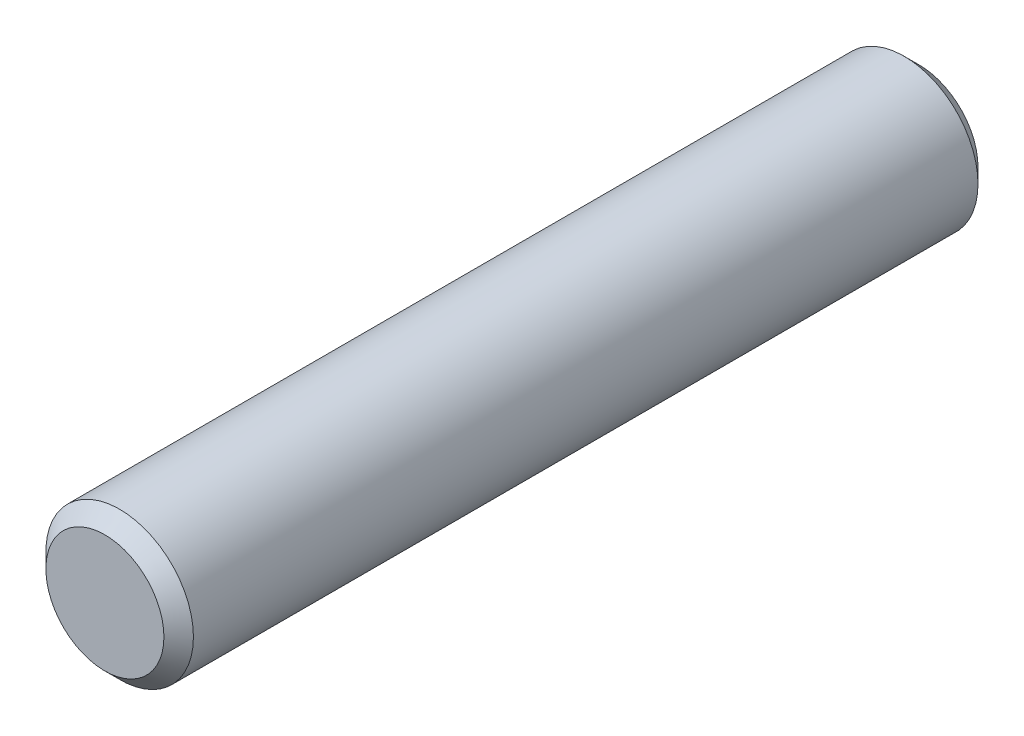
SolidWorks part; units mm, degrees
ref_plane "Front" through (0, 0, 0) normal (0, 0, 1) x (1, 0, 0)
ref_plane "Top" through (0, 0, 0) normal (0, 1, 0) x (1, 0, 0)
ref_plane "Right" through (0, 0, 0) normal (1, 0, 0) x (0, 0, -1)
sketch "Sketch1" plane through (0, 0, 0) normal (1, 0, 0) x (0, 0, -1)
  line L0 (0, 0) -> (65.3053, 0) construction
  line L1 (0, 0) -> (0, 2.541)
  line L2 (0, 2.541) -> (0.6353, 3.1763)
  line L3 (0.6353, 3.1763) -> (35.052, 3.1763)
  line L4 (35.052, 3.1763) -> (35.052, 2.541)
  line L5 (35.052, 2.541) -> (35.6873, 3.1763)
  line L6 (35.6873, 3.1763) -> (330.2, 3.1763)
  line L7 (330.2, 3.1763) -> (330.2, 11.43)
  line L8 (330.2, 11.43) -> (332.74, 12.7)
  line L9 (332.74, 12.7) -> (353.06, 12.7)
  line L10 (353.06, 12.7) -> (355.6, 10.16)
  line L11 (355.6, 10.16) -> (355.6, 0)
  line L12 (0, 0) -> (355.6, 0)
revolve "Revolve1" add sketch "Sketch1" angle 360 about L0
sketch "Sketch2" plane through (0, 0, -330.2) normal (0, 0, 1) x (1, 0, 0)
  circle A0 centre (0, 0) radius 53.975
  dimension "D1" = 107.95
extrude "Type123-N" [suppressed] cut sketch "Sketch2" along normal through all
sketch "123KeyDepth" [suppressed] plane through (0, 0, -28.448) normal (0, 0, -1) x (-1, 0, 0)
  line L0 (0, 0) -> (0, 1.5748) construction
  line L1 (-0.5766, 1.5748) -> (0.5714, 1.5748) construction
ref_plane "123Plane" [suppressed] through (0, 1.5748, 0) normal (0, -1, 0) x (1, 0, 0)
sketch "Sketch4" [suppressed] plane through (0, 1.5748, 0) normal (0, -1, 0) x (1, 0, 0)
  line L0 (0.0026, -28.448) -> (0.0026, -38.0533) construction
  line L1 (0.5766, -28.448) -> (-0.5714, -28.448) construction
  line L2 (0.8027, -28.448) -> (0.8027, -19.812)
  line L3 (-0.7975, -19.812) -> (-0.7975, -28.448)
  line L5 (-3.9689, -19.812) -> (2.9563, -19.812) construction
  line L6 (-1.8999, -28.448) -> (1.8999, -28.448) construction
  line L7 (-0.7975, -28.448) -> (0.8027, -28.448)
  arc A0 (0.8027, -19.812) -> (-0.7975, -19.812) centre (0.0026, -19.812) ccw
extrude "123Key" [suppressed] cut sketch "Sketch4" against normal through all
sketch "Sketch5" plane through (0, 0, -35.052) normal (0, 0, -1) x (-1, 0, 0)
  circle A0 centre (0, 0) radius 63.5
  dimension "D1" = 127
extrude "Type4" cut sketch "Sketch5" along normal through all
chamfer "Type4-Chamfer" distance 0.6353 angle 45 1 edges at (3.1763, 0, -35.052)
sketch "4KeyDepth" [suppressed] plane through (0, 0, -72.136) normal (0, 0, -1) x (-1, 0, 0)
  line L0 (0, 0) -> (0, 9.525) construction
  line L1 (-17.7759, 9.525) -> (18.3619, 9.525) construction
ref_plane "4Plane" [suppressed] through (0, 9.525, 0) normal (0, -1, 0) x (1, 0, 0)
sketch "Sketch7" [suppressed] plane through (0, 9.525, 0) normal (0, -1, 0) x (1, 0, 0)
  line L0 (-0.293, -72.136) -> (-0.293, -158.7004) construction
  line L1 (17.7759, -72.136) -> (-18.3619, -72.136) construction
  line L2 (2.882, -72.136) -> (2.882, -32.0291)
  line L3 (-3.468, -72.136) -> (-3.468, -32.0291)
  line L4 (-3.468, -72.136) -> (2.882, -72.136)
  line L5 (-10.16, -72.136) -> (10.16, -72.136) construction
  line L6 (-10.16, -72.136) -> (10.16, -72.136) construction
  arc A0 (2.882, -32.0291) -> (-3.468, -32.0291) centre (-0.293, -34.036) ccw
extrude "4Key" [suppressed] cut sketch "Sketch7" against normal through all
equation "\"DChamp3@Sketch1\"=.1*\"D@Sketch1\""
equation "\"DChamp1@Sketch1\"=.1*\"D@Sketch1\""
equation "\"DChamp2@Sketch1\"=.1*\"D@Sketch1\""
equation "\"DChamp4@Sketch1\"=.1*\"D@Sketch1\""
equation "\"CChamp1@Sketch1\"=.1*\"C@Sketch1\""
equation "\"CChamp5@Sketch1\"=.9*\"C@Sketch1\""
equation "\"CChamp3@Sketch1\"=.1*\"C@Sketch1\""
equation "\"CChamp4@Sketch1\"=.1*\"C@Sketch1\""
equation "\"D2@Sketch1\"=\"D@Sketch1\""
equation "\"KeyDepth@123KeyDepth\"=(\"C@Sketch1\"/2)-(\"F@Sketch4\"/2)"
equation "\"Type4KeyDepth@4KeyDepth\"=(\"D@Sketch1\"/2)-(\"4F@Sketch7\"/2)"
equation "\"4F2@Sketch7\"=\"4F@Sketch7\"/2"
